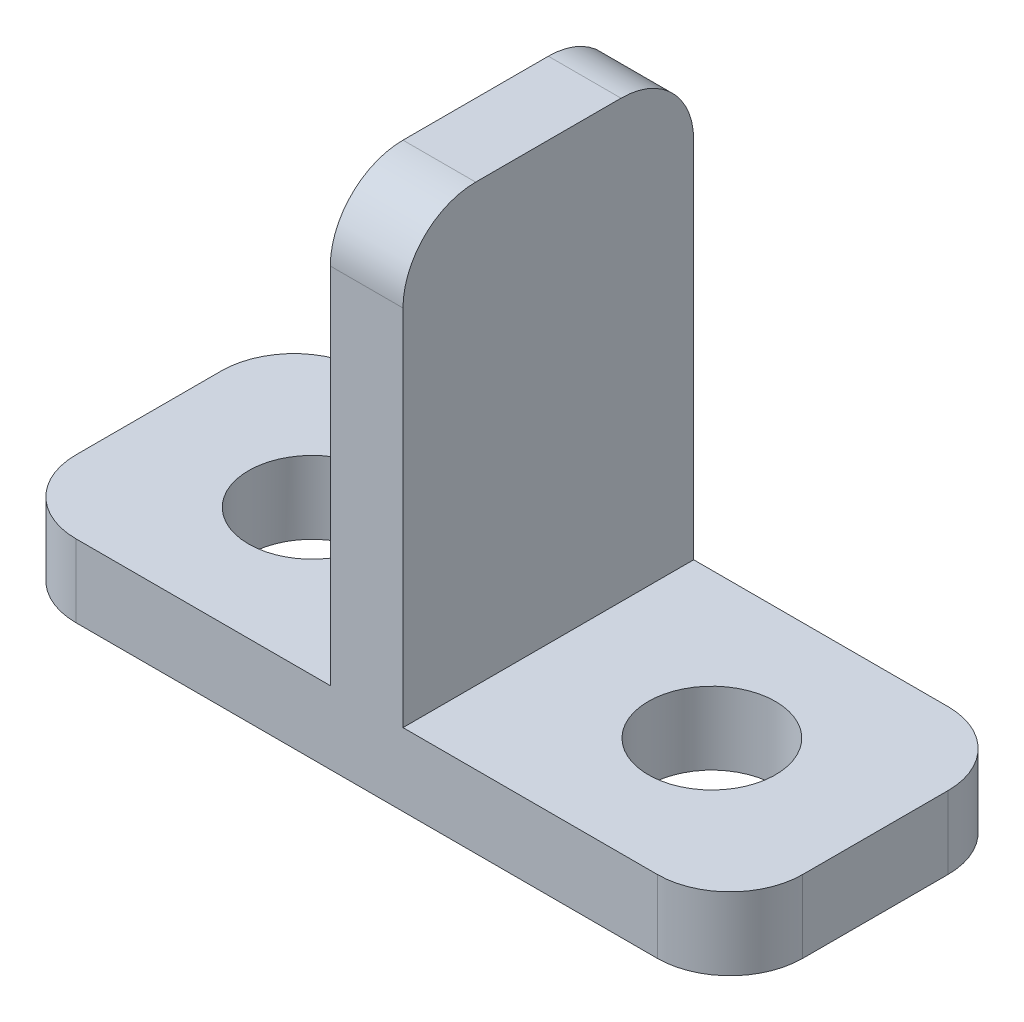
SolidWorks part; units mm, degrees
ref_plane "Спереди" through (0, 0, 0) normal (0, 0, 1) x (1, 0, 0)
ref_plane "Сверху" through (0, 0, 0) normal (0, 1, 0) x (1, 0, 0)
ref_plane "Справа" through (0, 0, 0) normal (1, 0, 0) x (0, 0, -1)
sketch "Эскиз1" plane through (0, 0, 0) normal (0, 1, 0) x (1, 0, 0)
  line L1 (-10, -4) -> (10, -4)
  line L2 (-10, -4) -> (-10, 4)
  line L3 (-10, 4) -> (10, 4)
  line L4 (10, -4) -> (10, 4)
  line L5 (-10, -4) -> (10, 4) construction
  line L6 (-10, 4) -> (10, -4) construction
  point P0 (0, 0)
  dimension "D1" = 20
  dimension "D2" = 8
extrude "Бобышка-Вытянуть1" add sketch "Эскиз1" along normal blind 2
sketch "Эскиз2" plane through (0, 2, 0) normal (0, 1, 0) x (1, 0, 0)
  line L0 (10, 4) -> (-10, 4) construction
  line L1 (-1, -4) -> (1, -4)
  line L2 (-1, -4) -> (-1, 4)
  line L3 (-1, 4) -> (1, 4)
  line L4 (1, -4) -> (1, 4)
  line L5 (-1, -4) -> (1, 4) construction
  line L6 (-1, 4) -> (1, -4) construction
  point P0 (0, 0)
  dimension "D1" = 2
extrude "Бобышка-Вытянуть2" add sketch "Эскиз2" along normal blind 12
sketch "Эскиз3" plane through (0, 2, 0) normal (0, 1, 0) x (1, 0, 0)
  line L0 (-10, 0) -> (-1, 0) construction
  line L1 (-10, 4) -> (-10, -4) construction
  line L2 (-1, 4) -> (-1, -4) construction
  line L3 (0, 0) -> (0, 7.6201) construction
  circle A0 centre (-5.5, 0) radius 1.75
  circle A1 centre (5.5, 0) radius 1.75
  dimension "D1" = 3.5
extrude "Вырез-Вытянуть1" cut sketch "Эскиз3" against normal blind 10
fillet "Скругление1" radius 2 6 edges at (0, 14, -4) (0, 14, 4) (10, 1, -4) (10, 1, 4) (-10, 1, 4) (-10, 1, -4)
